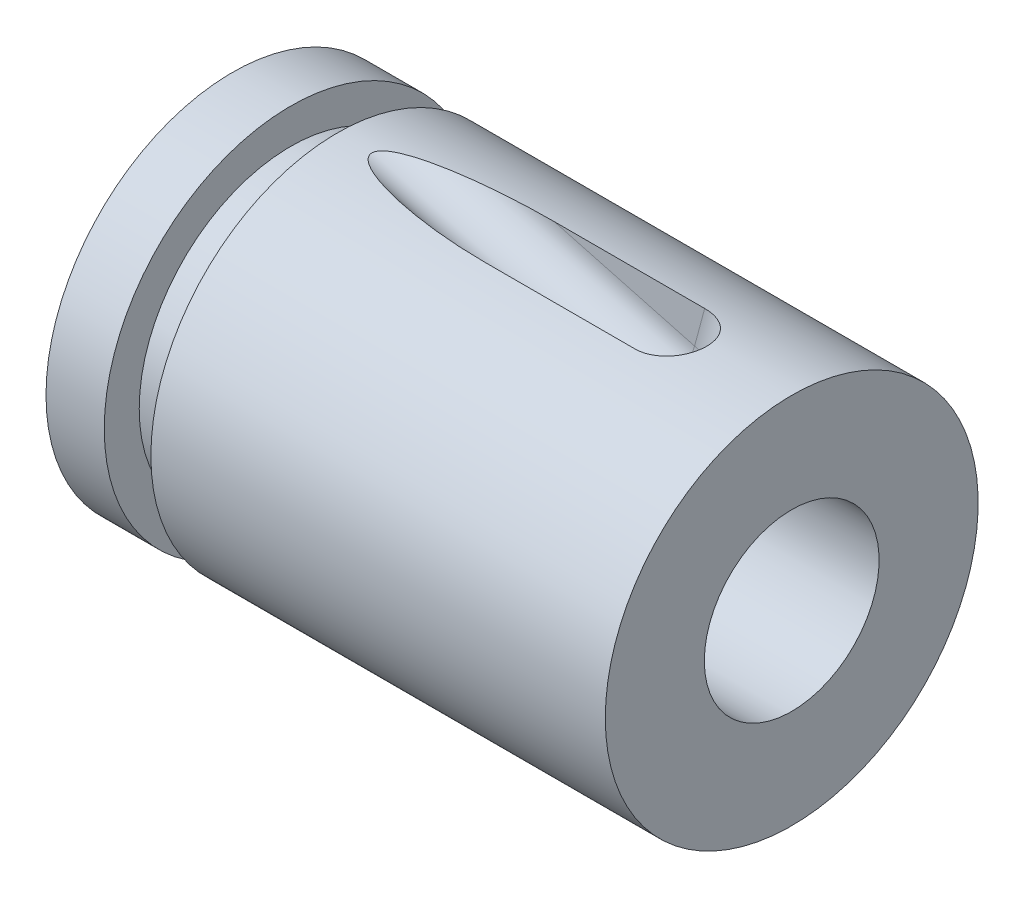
SolidWorks part; units mm, degrees
ref_plane "Plan de face" through (0, 0, 0) normal (0, 0, 1) x (1, 0, 0)
ref_plane "Plan de dessus" through (0, 0, 0) normal (0, 1, 0) x (1, 0, 0)
ref_plane "Plan de droite" through (0, 0, 0) normal (1, 0, 0) x (0, 0, -1)
sketch "Esquisse1" plane through (0, 0, 0) normal (0, 0, 1) x (1, 0, 0)
  line L0 (-20.0428, 0) -> (73.7575, 0) construction
  line L1 (0, 5.75) -> (0, 8)
  line L2 (0, 8) -> (2.5, 8)
  line L3 (2.5, 8) -> (2.5, 6.5)
  line L4 (2.5, 6.5) -> (4.5, 6.5)
  line L5 (4.5, 6.5) -> (4.5, 8)
  line L6 (4.5, 8) -> (24, 8)
  line L7 (24, 8) -> (24, 3.75)
  line L8 (24, 3.75) -> (2, 3.75)
  line L9 (2, 3.75) -> (0, 5.75)
  point P12 (0, 3.75)
  dimension "D1" = 7.5
  dimension "D2" = 2.5
  dimension "D3" = 2
  dimension "D4" = 24
  dimension "D5" = 16
  dimension "D6" = 16
  dimension "D7" = 13
  dimension "D8" = 2
  dimension "D9" = 45
revolve "Révolution1" add sketch "Esquisse1" angle 360 about L0
sketch "Esquisse2" plane through (0, 0, 0) normal (0, 0, 1) x (1, 0, 0)
  line L4 (5.8882, 9.4489) -> (19.7482, 5.7351)
  point P9 (21.5, 3.7128)
ref_plane "Plan1" through (5.8882, 9.4489, 0) normal (0.9659, -0.2588, 0) x (0, 0, -1)
sketch "Esquisse3" plane through (5.8882, 9.4489, 0) normal (0.9659, -0.2588, 0) x (0, 0, -1)
  line L2 (1.5, 0.1259) -> (1.5, 4.8017)
  line L3 (-1.5, 0.1259) -> (-1.5, 4.8017)
  line L4 (-1.5, 4.8017) -> (1.5, 4.8017)
  arc A0 (-1.5, 0.1259) -> (1.5, 0.1259) centre (0, 0.1259) ccw
sweep "Enlèvement de matière-Balayage4" cut profiles "Esquisse3" path "Esquisse2"
fillet "Congé1" radius 1.5 3 edges at (20.049, 6.8574, 1.5) (20.049, 6.8574, -1.5) (19.3926, 4.4078, 0)
